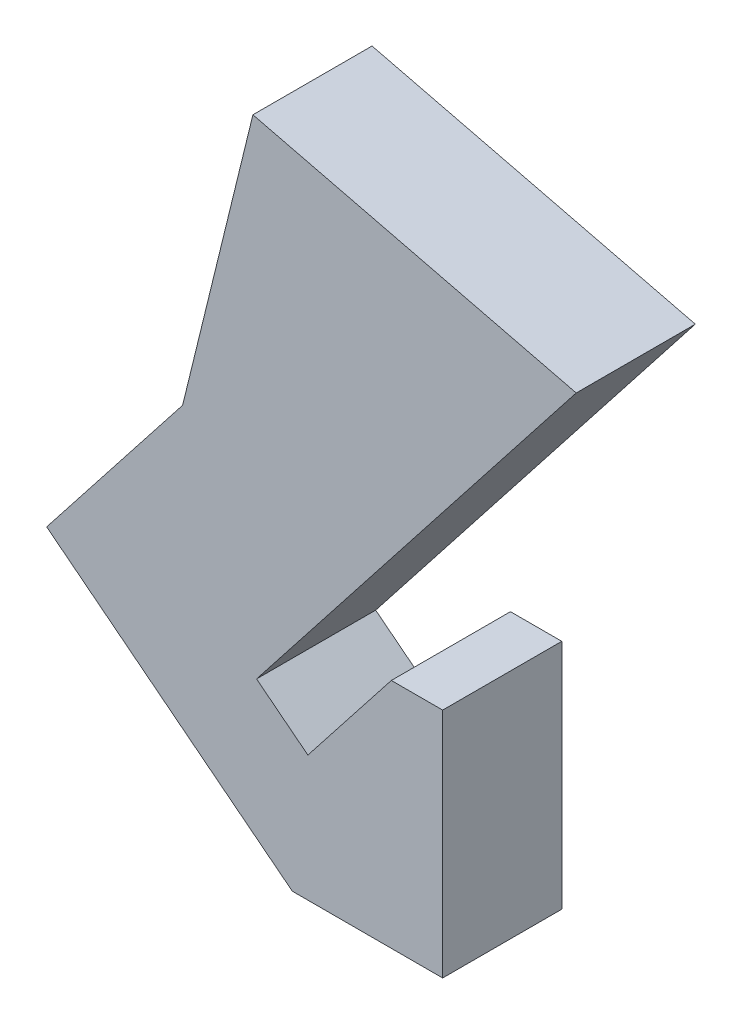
SolidWorks part; units mm, degrees
ref_plane "Front" through (0, 0, 0) normal (0, 0, 1) x (1, 0, 0)
ref_plane "Top" through (0, 0, 0) normal (0, 1, 0) x (1, 0, 0)
ref_plane "Right" through (0, 0, 0) normal (1, 0, 0) x (0, 0, -1)
sketch "Sketch1" plane through (0, 0, 0) normal (0, 0, 1) x (1, 0, 0)
  line L0 (0, 0) -> (-7.3745, 0)
  line L1 (-7.3745, 0) -> (-19.4205, 9.4494)
  line L2 (-19.4205, 9.4494) -> (-12.7532, 17.9489)
  line L3 (-9.3058, 32.0105) -> (6.5497, 28.1233)
  line L4 (6.5497, 28.1233) -> (-9.1272, 8.1384)
  line L5 (-9.1272, 8.1384) -> (-6.6091, 6.1631)
  line L6 (-6.6091, 6.1631) -> (-2.5174, 11.3792)
  line L7 (-2.5174, 11.3792) -> (0, 11.3792)
  line L8 (0, 11.3792) -> (0, 0)
  line L9 (-7.3745, 0) -> (-26.833, 0) construction
  line L10 (-26.833, 0) -> (-19.4205, 9.4494) construction
  line L11 (0, 11.3792) -> (18.5928, 11.3792) construction
  line L12 (-2.5174, 11.3792) -> (9.0678, 26.148) construction
  line L13 (9.0678, 26.148) -> (6.5497, 28.1233) construction
  line L14 (9.0678, 26.148) -> (9.0678, 11.3792) construction
  line L15 (6.5497, 28.1233) -> (1.184, 28.1233) construction
  line L16 (-12.7532, 17.9489) -> (-9.3058, 32.0105)
  dimension "D1" = 25.4
  dimension "D2" = 3.2004
  dimension "D3" = 51.888
  dimension "D4" = 9.525
  dimension "D5" = 9.0678
  dimension "D6" = 11.3792
  dimension "D7" = 13.775
  dimension "D8" = 6.6294
  dimension "D9" = 14.478
extrude "Extrude1" add sketch "Sketch1" along normal blind 5.842
sketch "FOV angles and such" plane through (0, 0, 5.842) normal (0, 0, 1) x (1, 0, 0)
  line L0 (9.0679, 26.1479) -> (9.0679, -2.3148) construction
  line L1 (9.0679, -2.3148) -> (0.1501, 14.7797) construction
  line L3 (9.0679, 11.0748) -> (2.0829, 11.0748) construction
  line L6 (-2.5174, 11.3792) -> (15.1698, 33.9264) construction
  line L7 (0.1501, 14.7797) -> (49.2602, 14.7797) construction
  line L8 (0.1501, 14.7797) -> (42.7771, 4.3292) construction
  line L9 (-2.5174, 11.3792) -> (-5.6635, 11.3792) construction
  line L10 (-1.5563, 18.0507) -> (-3.433, 15.6582) construction
  line L13 (-3.433, 15.6582) -> (-0.7883, 13.5835) construction
  line L14 (-1.5563, 18.0507) -> (1.0885, 15.976) construction
  line L15 (-2.4946, 16.8544) -> (0.1501, 14.7797) construction
  line L16 (6.5497, 28.1233) -> (9.0679, 26.1479) construction
  line L17 (6.5497, 28.1233) -> (3.101, 14.0563) construction
  dimension "D1" = 27.55
  dimension "D2" = 13.775
  dimension "D3" = 6.985
